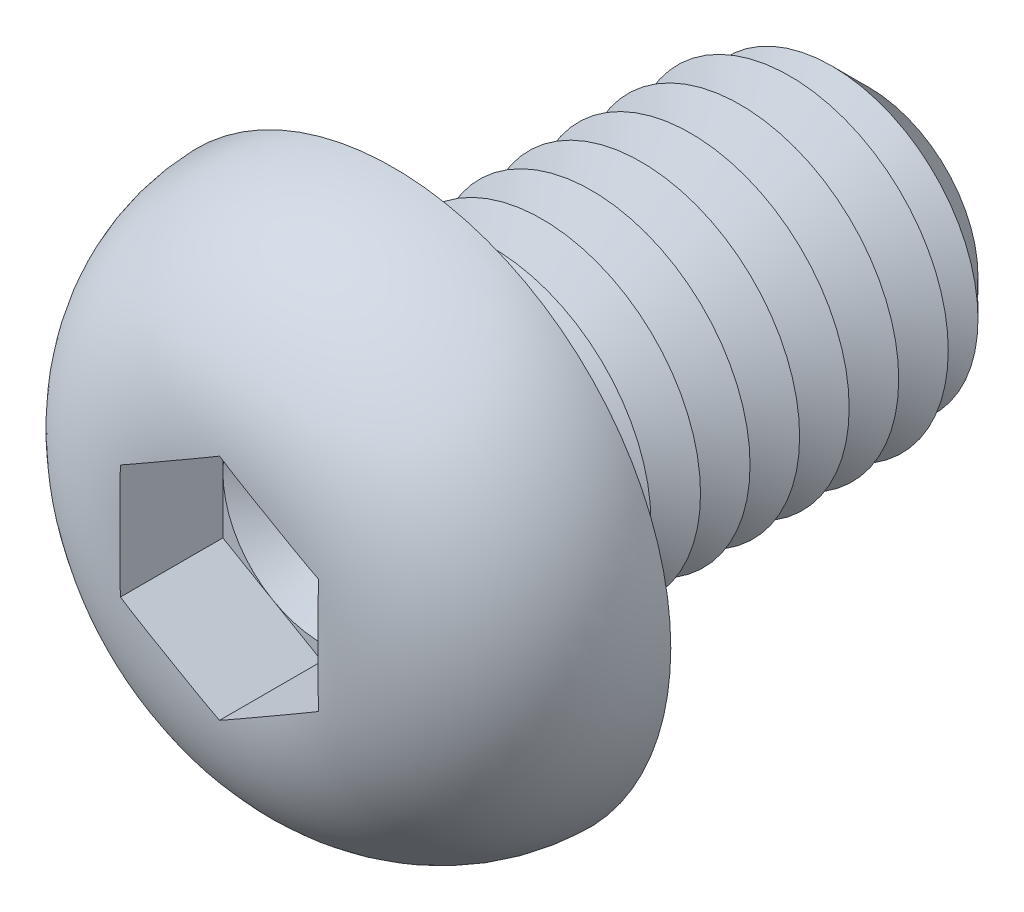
SolidWorks part; units mm, degrees
ref_plane "Front Plane" through (0, 0, 0) normal (0, 0, 1) x (1, 0, 0)
ref_plane "Top Plane" through (0, 0, 0) normal (0, 1, 0) x (1, 0, 0)
ref_plane "Right Plane" through (0, 0, 0) normal (1, 0, 0) x (0, 0, -1)
sketch "Sketch1" plane through (0, 0, 0) normal (1, 0, 0) x (0, 0, -1)
  line L0 (-47.9342, 0) -> (60.3146, 0) construction
sketch "Sketch2" plane through (0, 0, 0) normal (1, 0, 0) x (0, 0, -1)
  line L0 (0, 0) -> (-4.4, 0)
  line L1 (-47.9342, 0) -> (60.3146, 0) construction
  line L2 (-4.4, 0) -> (-4.4, 2.5011)
  line L3 (0, 7) -> (0, 0)
  arc A0 (-4.4, 2.5011) -> (0, 7) centre (0.1, 2.5011) cw
  dimension "D1" = 4.5
  dimension "D2" = 4.4
  dimension "D3" = 7
revolve "Revolve1" add sketch "Sketch2" angle 360 about L0
sketch "Sketch3" plane through (0, 0, 4.4) normal (0, 0, 1) x (1, 0, 0)
  line L1 (0, 2.8868) -> (-2.5, 1.4434)
  line L2 (-2.5, 1.4434) -> (-2.5, -1.4434)
  line L3 (-2.5, -1.4434) -> (0, -2.8868)
  line L4 (0, -2.8868) -> (2.5, -1.4434)
  line L5 (2.5, -1.4434) -> (2.5, 1.4434)
  line L6 (2.5, 1.4434) -> (0, 2.8868)
  circle A0 centre (0, 0) radius 2.5 construction
  dimension "D1" = 5
extrude "Cut-Extrude1" cut sketch "Sketch3" against normal blind 2.6
sketch "Sketch4" plane through (0, 0, 0) normal (0, 0, -1) x (-1, 0, 0)
  circle A0 centre (0, 0) radius 4
  dimension "D1" = 8
extrude "Boss-Extrude1" add sketch "Sketch4" along normal blind 12
chamfer "Chamfer1" distance 1.25 angle 45 1 edges at (-4, 0, -12)
sketch "Sketch5" plane through (0, 0, 0) normal (1, 0, 0) x (0, 0, -1)
  line L0 (1.25, 4) -> (2.5, 4)
  line L1 (10.75, 4) -> (0, 4) construction
  line L2 (2.5, 4) -> (1.875, 2.9175)
  line L3 (1.875, 2.9175) -> (1.25, 4)
  line L4 (0, -7) -> (0, 7) construction
  line L5 (10.75, 4) -> (0, 4) construction
  dimension "D1" = 1.25
  dimension "D2" = 1.25
revolve "Cut-Revolve1" cut sketch "Sketch5" angle 360 about L0
pattern_linear "LPattern1" count 9 spacing 1.25 along (0, 0, -1) of "Cut-Revolve1"
fillet "Fillet2" radius 0.5 1 edges at (4, 0, 0)
sketch "Sketch6" plane through (0, 0, 1.8) normal (0, 0, 1) x (1, 0, 0)
  line L0 (0, -2.8868) -> (2.5, -1.4434) construction
  circle A0 centre (0, 0) radius 2.5
extrude "Cut-Extrude2" cut sketch "Sketch6" against normal through all draft 60
